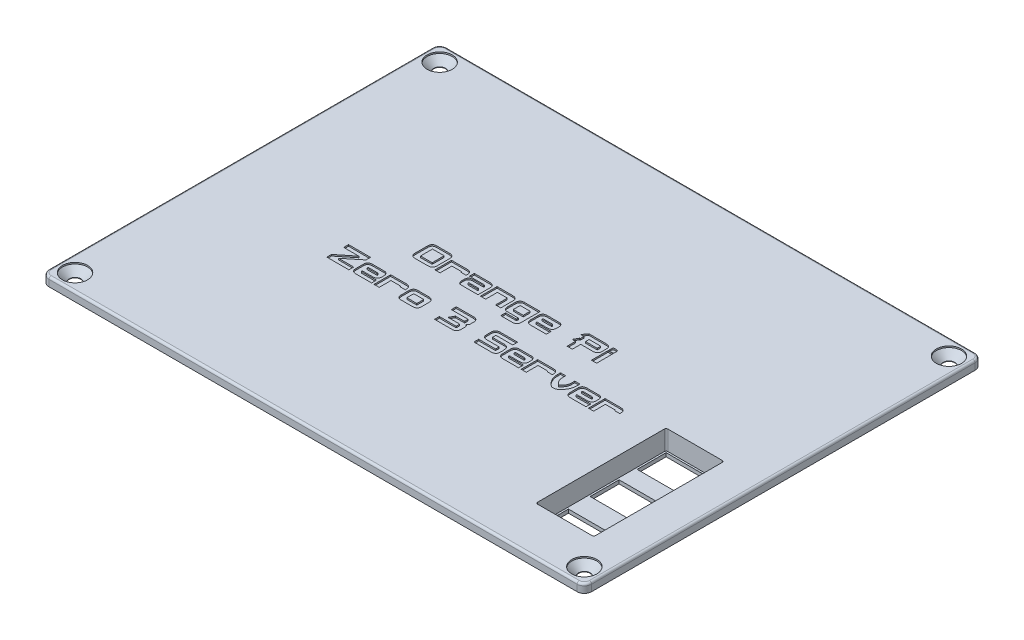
SolidWorks part; units mm, degrees
ref_plane "Front Plane" through (0, 0, 0) normal (0, 0, 1) x (1, 0, 0)
ref_plane "Top Plane" through (0, 0, 0) normal (0, 1, 0) x (1, 0, 0)
ref_plane "Right Plane" through (0, 0, 0) normal (1, 0, 0) x (0, 0, -1)
sketch "Sketch1" plane through (0, 0, 0) normal (0, 1, 0) x (1, 0, 0)
  line L1 (0, 0) -> (150, 0)
  line L2 (0, 0) -> (0, 110)
  line L3 (0, 110) -> (150, 110)
  line L4 (150, 0) -> (150, 110)
  dimension "D1" = 150
  dimension "D2" = 110
extrude "Boss-Extrude1" add sketch "Sketch1" along normal blind 2.4
hole_wizard "CSK for M3 Hex Socket Countersunk Head Screw1" positions "Sketch3" profile "Sketch4" countersink size "M3" standard "DIN"
sketch "Sketch3" plane through (0, 2.4, 0) normal (0, 1, 0) x (1, 0, 0)
  line L1 (4.6, 105.4) -> (145.4, 105.4) construction
  line L2 (4.6, 105.4) -> (4.6, 4.6) construction
  line L3 (4.6, 4.6) -> (145.4, 4.6) construction
  line L4 (145.4, 105.4) -> (145.4, 4.6) construction
  line L5 (0, 110) -> (0, 0) construction
  line L6 (150, 110) -> (0, 110) construction
  line L7 (150, 0) -> (150, 110) construction
  line L8 (0, 0) -> (150, 0) construction
  point P1 (4.6, 105.4)
  point P2 (145.4, 4.6)
  point P131 (4.6, 4.6)
  point P132 (145.4, 105.4)
  dimension "D1" = 4.6
  dimension "D2" = 4.6
  dimension "D3" = 4.6
  dimension "D4" = 4.6
sketch "Sketch4" plane through (4.6, 2.4, -105.4) normal (1, 0, 0) x (0, 0, 1)
  line L0 (0, 0) -> (0, 50.9614)
  line L1 (0, 50.9614) -> (1.6, 50)
  line L2 (1.6, 50) -> (1.6, 2.27)
  line L3 (1.6, 2.27) -> (3.47, 0.4)
  line L4 (3.47, 0.4) -> (3.47, 0)
  line L6 (3.47, 0) -> (0, 0)
  line L7 (-1.6, 2.27) -> (-3.47, 0.4) construction
  line L10 (0, 50.9614) -> (-1.6, 50) construction
  line L11 (0, -6.35) -> (0, 107.95) construction
  dimension "Hole Dia." = 3.2
  dimension "Hole Depth" = 50
  dimension "C'Sink Dia." = 6.94
  dimension "C'Sink Angle" = 90
  dimension "Drill Angle" = 118
  dimension "Head Clearance" = 0.4
fillet "Fillet1" radius 2 4 edges at (0, 1.2, 0) (0, 1.2, -110) (150, 1.2, -110) (150, 1.2, 0)
sketch "Sketch5" plane through (0, 2.4, 0) normal (0, 1, 0) x (1, 0, 0)
  line L0 (0, 55) -> (150, 55) construction
  line L1 (0, 108) -> (0, 2) construction
  line L2 (150, 2) -> (150, 108) construction
  line L3 (2, 0) -> (148, 0) construction
  text T0 "Orange Pi   Zero 3 Server" font "Skir" height 6
  dimension "D1" = 55
extrude "Cut-Extrude1" cut sketch "Sketch5" against normal blind 0.4
sketch "Sketch6" plane through (0, 0, 0) normal (0, -1, 0) x (-1, 0, 0)
  line L0 (-150, 2) -> (-150, 108) construction
  line L1 (-139, 13.6) -> (-124, 13.6) construction
  line L2 (-139, 13.6) -> (-139, 48.6) construction
  line L3 (-139, 48.6) -> (-124, 48.6) construction
  line L4 (-124, 13.6) -> (-124, 48.6) construction
  line L5 (-2, 0) -> (-148, 0) construction
  point P6 (0, 0)
  point P7 (0, 0)
  point P8 (0, 0)
  dimension "D1" = 11
  dimension "D2" = 13.6
  dimension "D3" = 35
  dimension "D4" = 15
sketch "Sketch7" plane through (0, 0, 0) normal (0, -1, 0) x (-1, 0, 0)
  line L0 (-131.5, 13.6) -> (-131.5, 48.6) construction
  line L1 (-139, 13.6) -> (-124, 13.6) construction
  line L2 (-139, 48.6) -> (-124, 48.6) construction
  line L3 (-139, 13.6) -> (-139, 48.6) construction
  line L4 (-121.1, 51.5) -> (-141.9, 51.5)
  line L5 (-121.1, 51.5) -> (-121.1, 10.7)
  line L6 (-121.1, 10.7) -> (-141.9, 10.7)
  line L7 (-141.9, 51.5) -> (-141.9, 10.7)
  line L8 (-121.1, 51.5) -> (-141.9, 10.7) construction
  line L9 (-121.1, 10.7) -> (-141.9, 51.5) construction
  point P6 (-131.5, 31.1)
  dimension "D1" = 2.9
  dimension "D2" = 2.9
extrude "Boss-Extrude2" add sketch "Sketch7" along normal blind 4
sketch "Sketch8" plane through (0, 2.4, 0) normal (0, 1, 0) x (1, 0, 0)
  line L0 (131.5, 48.6) -> (131.5, 13.6) construction
  line L1 (139, 48.6) -> (124, 48.6) construction
  line L2 (139, 13.6) -> (124, 13.6) construction
  line L3 (124, 13.6) -> (124, 48.6) construction
  line L4 (123.5, 13.1) -> (139.5, 13.1)
  line L5 (123.5, 13.1) -> (123.5, 49.1)
  line L6 (123.5, 49.1) -> (139.5, 49.1)
  line L7 (139.5, 13.1) -> (139.5, 49.1)
  line L8 (123.5, 13.1) -> (139.5, 49.1) construction
  line L9 (123.5, 49.1) -> (139.5, 13.1) construction
  point P6 (131.5, 31.1)
  dimension "D1" = 0.5
  dimension "D2" = 0.5
extrude "Cut-Extrude2" cut sketch "Sketch8" against normal offset from surface (5.4 mm away) 1
fillet "Fillet2" radius 0.5 4 edges at (123.5, -0.3, -13.1) (139.5, -0.3, -13.1) (139.5, -0.3, -49.1) (123.5, -0.3, -49.1)
sketch "Sketch9" plane through (0, -4, 0) normal (0, -1, 0) x (-1, 0, 0)
  line L0 (-139, 48.6) -> (-124, 48.6)
  line L1 (-138.5, 14.1) -> (-124.5, 14.1) construction
  line L2 (-138.5, 14.1) -> (-138.5, 21.1) construction
  line L3 (-138.5, 21.1) -> (-124.5, 21.1) construction
  line L4 (-124.5, 14.1) -> (-124.5, 21.1) construction
  line L5 (-138.5, 28.1) -> (-124.5, 28.1) construction
  line L6 (-138.5, 28.1) -> (-138.5, 35.1) construction
  line L7 (-138.5, 35.1) -> (-124.5, 35.1) construction
  line L8 (-124.5, 28.1) -> (-124.5, 35.1) construction
  line L9 (-138.5, 41.1) -> (-124.5, 41.1) construction
  line L10 (-138.5, 41.1) -> (-138.5, 48.1) construction
  line L11 (-138.5, 48.1) -> (-124.5, 48.1) construction
  line L12 (-124.5, 41.1) -> (-124.5, 48.1) construction
  line L13 (-124, 40.6) -> (-124, 48.6)
  line L14 (-139, 40.6) -> (-124, 40.6)
  line L15 (-139, 40.6) -> (-139, 48.6)
  line L16 (-139, 35.6) -> (-124, 35.6)
  line L17 (-124, 27.6) -> (-124, 35.6)
  line L18 (-139, 27.6) -> (-124, 27.6)
  line L19 (-139, 27.6) -> (-139, 35.6)
  line L20 (-139, 21.6) -> (-124, 21.6)
  line L21 (-124, 13.6) -> (-124, 21.6)
  line L22 (-139, 13.6) -> (-124, 13.6)
  line L23 (-139, 13.6) -> (-139, 21.6)
  dimension "D1" = 0.5
extrude "Cut-Extrude3" cut sketch "Sketch9" against normal through all
fillet "Fillet3" radius 0.5 4 edges at (121.1, -2, -51.5) (141.9, -2, -51.5) (121.1, -2, -10.7) (141.9, -2, -10.7)
fillet "Fillet5" radius 0.6 8 edges at (0.5858, 2.4, -0.5858) (0, 2.4, -55) (0.5858, 2.4, -109.4142) (75, 2.4, -110) (149.4142, 2.4, -109.4142) (150, 2.4, -55) (149.4142, 2.4, -0.5858) (75, 2.4, 0)
